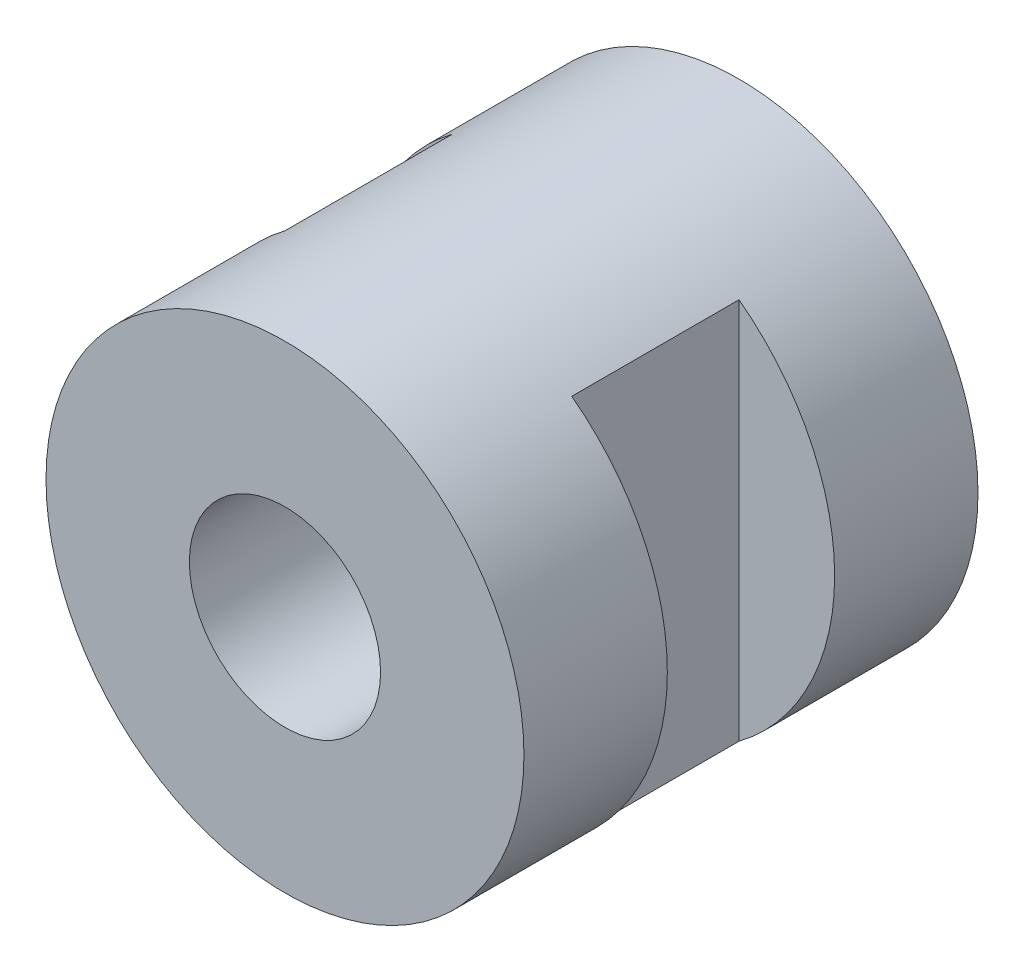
SolidWorks part; units mm, degrees
ref_plane "前视基准面" through (0, 0, 0) normal (0, 0, 1) x (1, 0, 0)
ref_plane "上视基准面" through (0, 0, 0) normal (0, 1, 0) x (1, 0, 0)
ref_plane "右视基准面" through (0, 0, 0) normal (1, 0, 0) x (0, 0, -1)
sketch "草图1" plane through (0, 0, 0) normal (0, 0, 1) x (1, 0, 0)
  circle A0 centre (0, 0) radius 5
extrude "凸台-拉伸1" add sketch "草图1" along normal blind 9.5
ref_plane "基准面1" through (0, 10, 0) normal (0, 1, 0) x (-1, 0, 0)
sketch "草图2" plane through (0, 10, 0) normal (0, 1, 0) x (-1, 0, 0)
  line L0 (-5, 9.5) -> (-5, 0) construction
  line L1 (-5.3837, 6.5) -> (-3, 6.5)
  line L2 (-5.3837, 6.5) -> (-5.3837, 3)
  line L3 (-5.3837, 3) -> (-3, 3)
  line L4 (-3, 6.5) -> (-3, 3)
  line L5 (0, 9.5) -> (0, 0) construction
  line L6 (5, 9.5) -> (-5, 9.5) construction
  line L7 (0, 4.75) -> (5.1425, 4.75) construction
  line L8 (5.3837, 3) -> (3, 3)
  line L9 (5.3837, 6.5) -> (5.3837, 3)
  line L10 (3, 6.5) -> (3, 3)
  line L11 (5.3837, 6.5) -> (3, 6.5)
  dimension "D1" = 2
  dimension "D2" = 3.5
extrude "切除-拉伸1" cut sketch "草图2" against normal through all
sketch "草图3" plane through (0, 0, 0) normal (0, 0, -1) x (-1, 0, 0)
  circle A0 centre (0, 0) radius 2
extrude "切除-拉伸2" cut sketch "草图3" against normal through all
